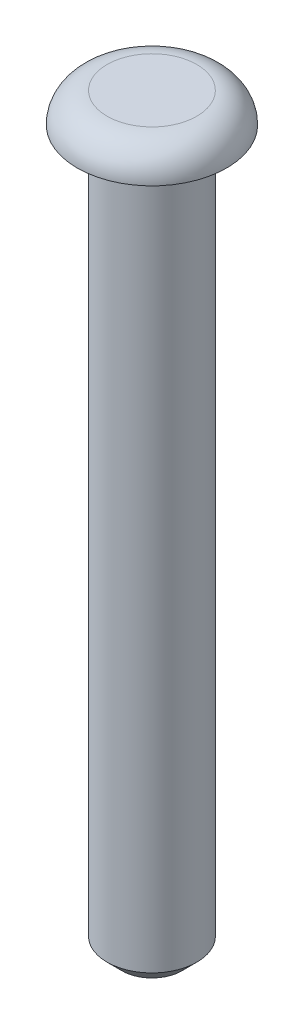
SolidWorks part; units mm, degrees
ref_plane "Front Plane" through (0, 0, 0) normal (0, 0, 1) x (1, 0, 0)
ref_plane "Top Plane" through (0, 0, 0) normal (0, 1, 0) x (1, 0, 0)
ref_plane "Right Plane" through (0, 0, 0) normal (1, 0, 0) x (0, 0, -1)
sketch "Sketch1" plane through (0, 0, 0) normal (0, 1, 0) x (1, 0, 0)
  circle A0 centre (0, 0) radius 2.3812
  dimension "D1" = 4.7625
extrude "Boss-Extrude1" add sketch "Sketch1" against normal blind 38.1
sketch "Sketch2" plane through (0, 0, 0) normal (0, 1, 0) x (1, 0, 0)
  circle A2 centre (0, 0) radius 3.9688
  circle A3 centre (0, 0) radius 3.9688
  dimension "D1" = 1.5875
extrude "Boss-Extrude2" add sketch "Sketch2" along normal blind 1.5875
fillet "Fillet1" radius 1.5875 1 edges at (0, 1.5875, 3.9688)
chamfer "Chamfer1" distance 0.7937 angle 45 1 edges at (0, -38.1, 2.3812)
